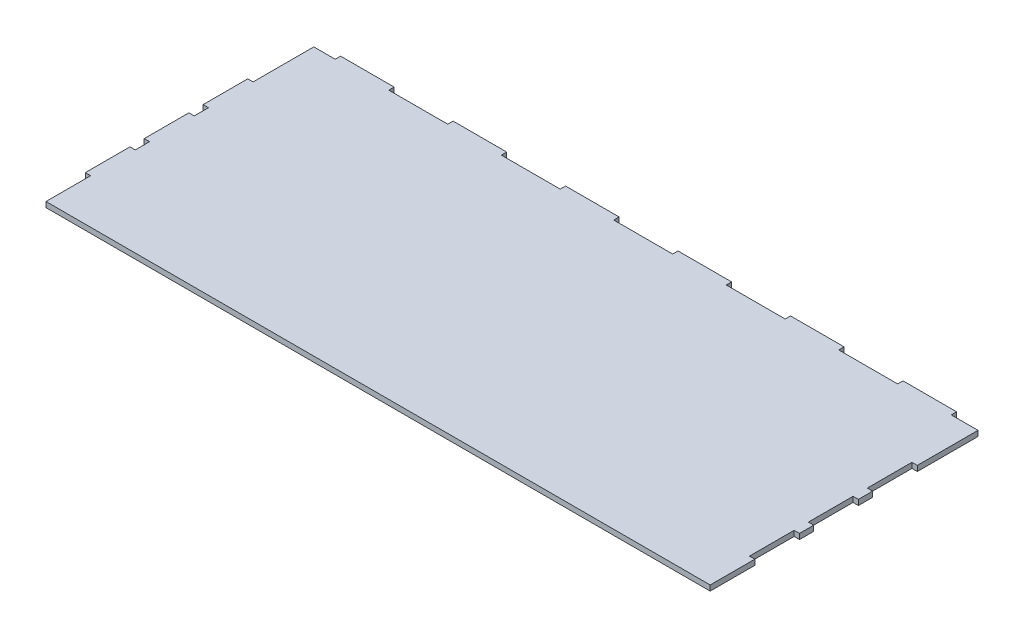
SolidWorks part; units mm, degrees
ref_plane "Front Plane" through (0, 0, 0) normal (0, 0, 1) x (1, 0, 0)
ref_plane "Top Plane" through (0, 0, 0) normal (0, 1, 0) x (1, 0, 0)
ref_plane "Right Plane" through (0, 0, 0) normal (1, 0, 0) x (0, 0, -1)
sketch "Sketch1" plane through (0, 0, 0) normal (0, 0, 1) x (1, 0, 0)
  line L0 (-125, -125) -> (-125, 125) construction
  line L1 (125, 125) -> (-123, 125)
  line L2 (125, 125) -> (125, 123)
  line L3 (125, 123) -> (-123, 123)
  line L4 (-123, 125) -> (-123, 123)
extrude "Boss-Extrude1" add sketch "Sketch1" along normal blind 100
sketch "Sketch2" plane through (-123, 0, 0) normal (-1, 0, 0) x (0, 0, 1)
  line L0 (100, 123) -> (0, 123) construction
  line L1 (83.3333, 123) -> (66.6667, 123)
  line L2 (83.3333, 123) -> (83.3333, 125)
  line L3 (83.3333, 125) -> (66.6667, 125)
  line L4 (66.6667, 123) -> (66.6667, 125)
  line L5 (100, 125) -> (0, 125) construction
  line L6 (100, 125) -> (100, 123) construction
extrude "Boss-Extrude2" add sketch "Sketch2" along normal blind 2
pattern_linear "LPattern1" count 3 spacing 22 along (0, 0, -1) of "Boss-Extrude2"
sketch "Sketch3" plane through (125, 0, 0) normal (1, 0, 0) x (0, 0, -1)
  line L0 (-22.6667, 125) -> (-22.6667, 123) construction
  line L1 (-39.3333, 125) -> (-22.6667, 125) construction
  line L2 (-22.6667, 123) -> (-39.3333, 123) construction
  line L3 (-39.3333, 123) -> (-39.3333, 125) construction
  line L4 (-44.6667, 125) -> (-44.6667, 123) construction
  line L5 (-61.3333, 125) -> (-44.6667, 125) construction
  line L6 (-44.6667, 123) -> (-61.3333, 123) construction
  line L7 (-61.3333, 123) -> (-61.3333, 125) construction
  line L8 (-66.6667, 125) -> (-66.6667, 123) construction
  line L9 (-66.6667, 123) -> (-83.3333, 123) construction
  line L10 (-83.3333, 123) -> (-83.3333, 125) construction
  line L11 (-83.3333, 125) -> (-66.6667, 125) construction
  line L12 (-22.6667, 125) -> (-22.6667, 123)
  line L13 (-39.3333, 125) -> (-22.6667, 125)
  line L14 (-22.6667, 123) -> (-39.3333, 123)
  line L15 (-39.3333, 123) -> (-39.3333, 125)
  line L16 (-44.6667, 125) -> (-44.6667, 123)
  line L17 (-61.3333, 125) -> (-44.6667, 125)
  line L18 (-44.6667, 123) -> (-61.3333, 123)
  line L19 (-61.3333, 123) -> (-61.3333, 125)
  line L20 (-66.6667, 125) -> (-66.6667, 123)
  line L21 (-66.6667, 123) -> (-83.3333, 123)
  line L22 (-83.3333, 123) -> (-83.3333, 125)
  line L23 (-83.3333, 125) -> (-66.6667, 125)
extrude "Cut-Extrude1" cut sketch "Sketch3" against normal blind 2
sketch "Sketch4" plane through (0, 0, 0) normal (0, 0, -1) x (-1, 0, 0)
  line L0 (-125, 125) -> (123, 125) construction
  line L1 (-115, 125) -> (-95, 125)
  line L2 (-115, 125) -> (-115, 123)
  line L3 (-115, 123) -> (-95, 123)
  line L4 (-95, 125) -> (-95, 123)
  line L5 (123, 123) -> (-125, 123) construction
  line L6 (-125, 123) -> (-125, 125) construction
  dimension "D1" = 10
  dimension "D2" = 20
extrude "Boss-Extrude3" add sketch "Sketch4" along normal blind 2
pattern_linear "LPattern2" count 6 spacing 42 along (-1, 0, 0) of "Boss-Extrude3"
equation "\"anch\" = 2"
equation "\"alt\" = 100"
equation "\"D1@Sketch1\"=\"anch\""
equation "\"D2@Sketch1\"=\"anch\""
equation "\"D1@Boss-Extrude1\"=\"alt\""
equation "\"D1@Sketch2\"=\"alt\"/6"
equation "\"D2@Sketch2\"=\"alt\"/6"
equation "\"D1@Boss-Extrude2\"=\"anch\""
equation "\"D1@Cut-Extrude1\"=\"anch\""
equation "\"D1@Boss-Extrude3\"=\"anch\""
